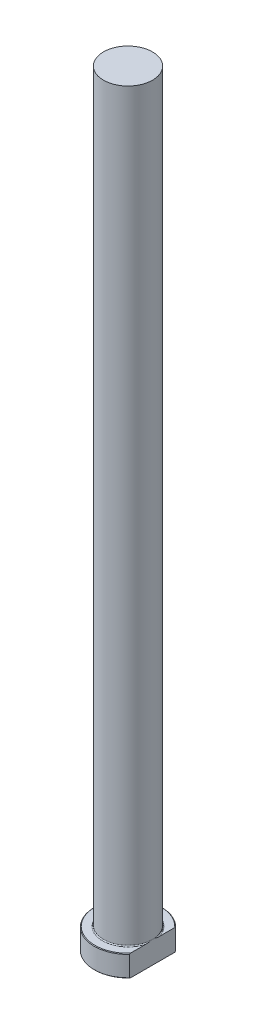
SolidWorks part; units mm, degrees
ref_plane "Front Plane" through (0, 0, 0) normal (0, 0, 1) x (1, 0, 0)
ref_plane "Top Plane" through (0, 0, 0) normal (0, 1, 0) x (1, 0, 0)
ref_plane "Right Plane" through (0, 0, 0) normal (1, 0, 0) x (0, 0, -1)
sketch "Sketch1" plane through (0, 0, 0) normal (0, 0, 1) x (1, 0, 0)
  line L0 (0, 259.9588) -> (0, -15.1925) construction
  line L1 (0, 0) -> (-11, 0)
  line L2 (-11, 0) -> (-11, 7)
  line L3 (-11, 7) -> (-8, 7)
  line L4 (-8, 7) -> (-8, 250)
  line L5 (-8, 250) -> (0, 250)
  line L6 (0, 250) -> (0, 0)
  dimension "L" = 250
  dimension "H" = 22
  dimension "T" = 7
  dimension "D" = 16
revolve "Revolve1" add sketch "Sketch1" angle 360 about L0
chamfer "Chamfer1" distance 0.2 angle 45 2 edges at (0, 7, 11) (0, 0, 11)
fillet "Fillet1" radius 0.3 1 edges at (0, 7, 8)
sketch "Sketch2" plane through (0, 0, 0) normal (0, 1, 0) x (1, 0, 0)
  line L0 (8, 7.5498) -> (8, -7.5498)
  circle A0 centre (0, 0) radius 11 construction
  arc A1 (8, -7.5498) -> (8, 7.5498) centre (0, 0) ccw
  circle A2 centre (0, 0) radius 8 construction
extrude "KEY" cut sketch "Sketch2" along normal through all
